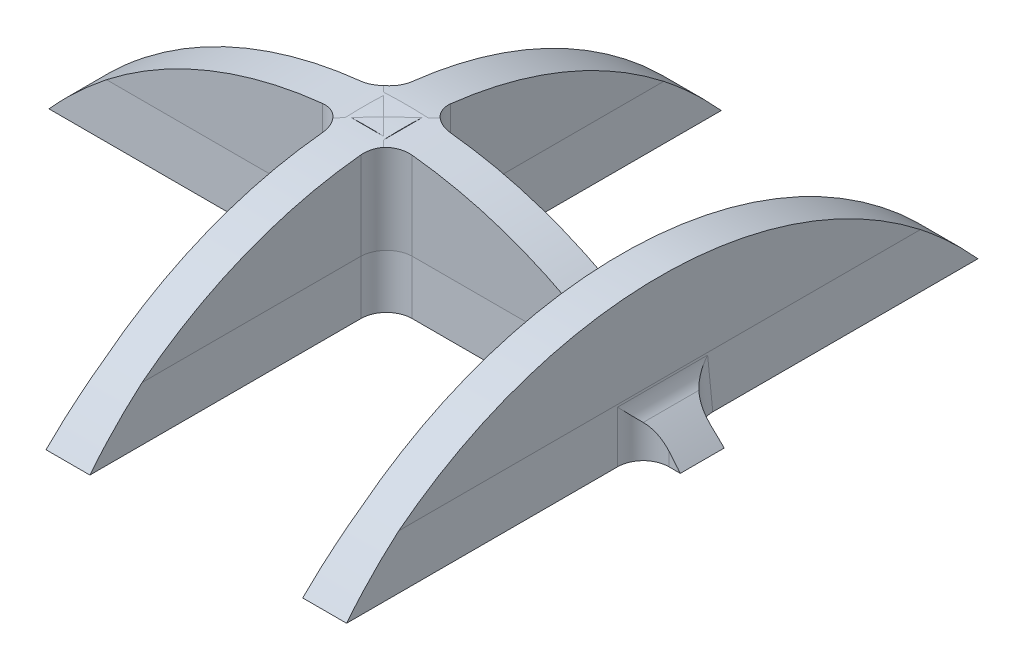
SolidWorks part; units mm, degrees
ref_plane "Vorderansicht" through (0, 0, 0) normal (0, 0, 1) x (1, 0, 0)
ref_plane "Draufsicht" through (0, 0, 0) normal (0, 1, 0) x (1, 0, 0)
ref_plane "Seitenansicht" through (0, 0, 0) normal (1, 0, 0) x (0, 0, -1)
other "Join1"
other "Part1-Rippe<1>@Assem1-Rippen"
other "Part1-Rippe<2>@Assem1-Rippen"
other "Part1-Rippe<3>@Assem1-Rippen"
fillet "Fillet1" radius 2 16 edges at (18.5, 26.6634, -1.5) (1.5, 29.4774, -1.5) (-1.5, 29.4774, -1.5) (18.5, 26.6634, 1.5) (1.5, 29.4829, 1.5) (-1.5, 29.4829, 1.5) (18.5, 27.3267, 0) (21.553, 24.9894, 0) (18.3952, 24, 1.6048) (21.6313, 23.4947, 1.6313) (-1.6048, 24, 1.6048) (1.6048, 24, 1.6048) (18.3952, 24, -1.6048) (21.6313, 23.4947, -1.6313) (-1.6048, 24, -1.6048) (1.6048, 24, -1.6048)
